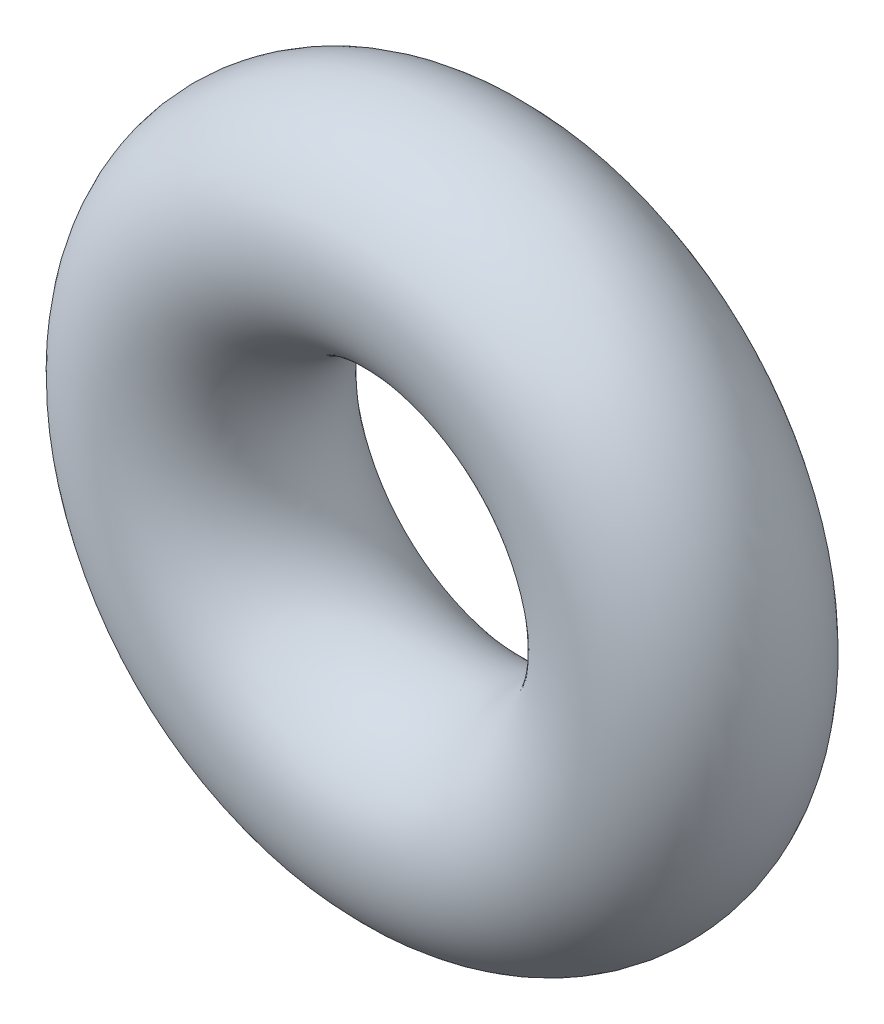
SolidWorks part; units mm, degrees
ref_plane "Face" through (0, 0, 0) normal (0, 0, 1) x (1, 0, 0)
ref_plane "Dessus" through (0, 0, 0) normal (0, 1, 0) x (1, 0, 0)
ref_plane "Droite" through (0, 0, 0) normal (1, 0, 0) x (0, 0, -1)
sketch "Esquisse2" plane through (0, 0, 0) normal (0, 1, 0) x (1, 0, 0)
  line L0 (6, -14) -> (6, 17) construction
  line L2 (-8, 0) -> (8, 0) construction
  line L3 (0, 0) -> (0, -8.722) construction
  circle A0 centre (11, -5) radius 5
  dimension "D1" = 10
revolve "Révolution1" add sketch "Esquisse2" angle 360 about L3
